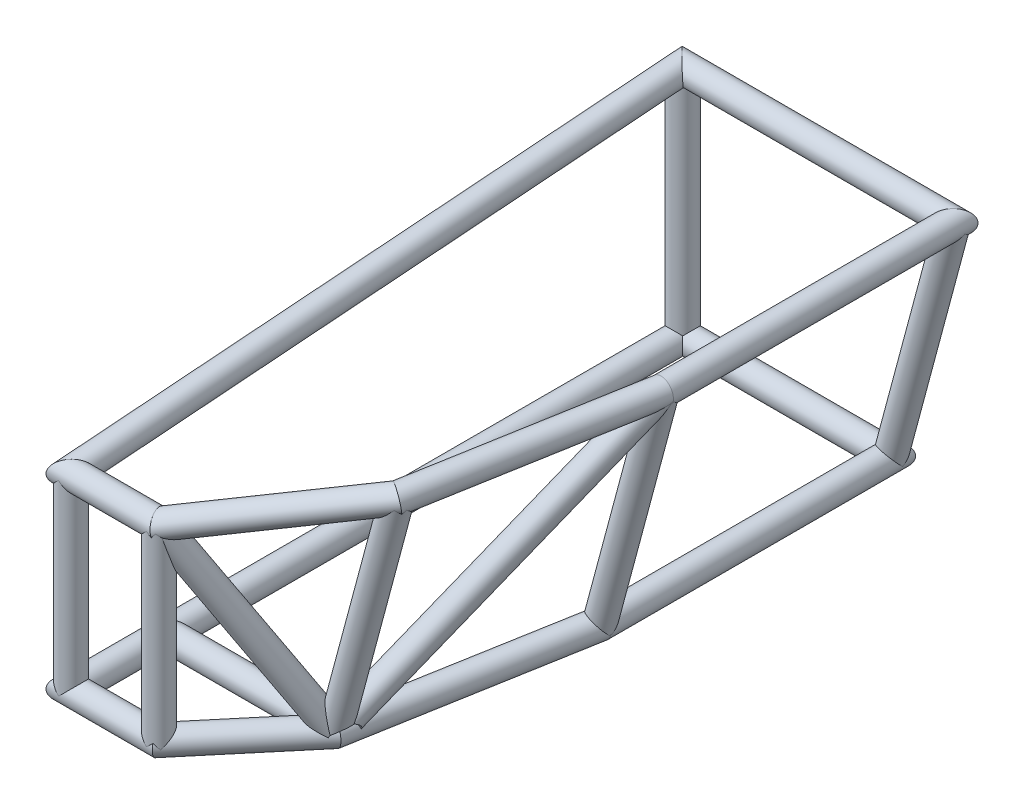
SolidWorks part; units mm, degrees
ref_plane "Front Plane" through (0, 0, 0) normal (0, 0, 1) x (1, 0, 0)
ref_plane "Top Plane" through (0, 0, 0) normal (0, 1, 0) x (1, 0, 0)
ref_plane "Right Plane" through (0, 0, 0) normal (1, 0, 0) x (0, 0, -1)
sketch3d "3DSketch1"
  line L0 (0, 0, 0) -> (0, 225, 0)
  line L1 (0, 225, 0) -> (105.8286, 225, 0)
  line L2 (105.8286, 225, 0) -> (105.8286, 0, 0)
  line L3 (105.8286, 0, 0) -> (0, 0, 0)
  line L4 (0, 225, 0) -> (0, 280.1185, -735.7288)
  line L5 (0, 280.1185, -735.7288) -> (325.0575, 280.1185, -735.7288)
  line L6 (250, 0, -735.7288) -> (325.0575, 280.1185, -735.7288)
  line L7 (325.0575, 280.1185, -735.7288) -> (325.0575, 280.1185, -385.7288)
  line L8 (325.0575, 280.1185, -385.7288) -> (277.3043, 280.1185, -114.9067)
  line L9 (0, 0, 0) -> (0, 0, -735.7288)
  line L10 (0, 0, -735.7288) -> (250, 0, -735.7288)
  line L11 (250, 0, -735.7288) -> (250, 0, -385.7288)
  line L12 (250, 0, -385.7288) -> (202.2468, 0, -114.9067)
  line L13 (202.2468, 0, -114.9067) -> (105.8286, 0, 0)
  line L14 (202.2468, 0, -114.9067) -> (0, 0, -114.9067)
  line L15 (105.8286, 225, 0) -> (202.2468, 0, -114.9067)
  line L16 (277.3043, 280.1185, -114.9067) -> (202.2468, 0, -114.9067)
  line L17 (202.2468, 0, -114.9067) -> (325.0575, 280.1185, -385.7288)
  line L18 (250, 0, -385.7288) -> (325.0575, 280.1185, -385.7288)
  line L19 (0, 0, -735.7288) -> (0, 280.1185, -735.7288)
  line L20 (277.3043, 280.1185, -114.9067) -> (105.8286, 225, 0)
  line L21 (325.0575, 280.1185, -385.7288) -> (250, 0, -735.7288)
  dimension "A" = 225
  dimension "D13" = 90
  dimension "D2" = 105
  dimension "D7" = 90
  dimension "D3" = 90
  dimension "D4" = 90
  dimension "D5" = 250
  dimension "D6" = 90
  dimension "D8" = 150
  dimension "D9" = 150
  dimension "D10" = 275
  dimension "D11" = 350
  dimension "D12" = 170
  dimension "B" = 290
  dimension "D14" = 90
  dimension "D15" = 90
  dimension "D16" = 90
  dimension "D17" = 90
  dimension "D18" = 90
other "Structural Member1"
ref_plane "Plane1" through (105.8286, 0, 0) normal (-1, 0, 0) x (0, 0, 1)
sketch "Sketch1" plane through (105.8286, 0, 0) normal (-1, 0, 0) x (0, 0, 1)
  circle A0 centre (0, 0) radius 10
  circle A1 centre (0, 0) radius 15
  point P4 (0, 0)
  dimension "D1" = 5
  dimension "D2" = 30
equation "\"A\"=225"
equation "\"B\"=290.000000"
